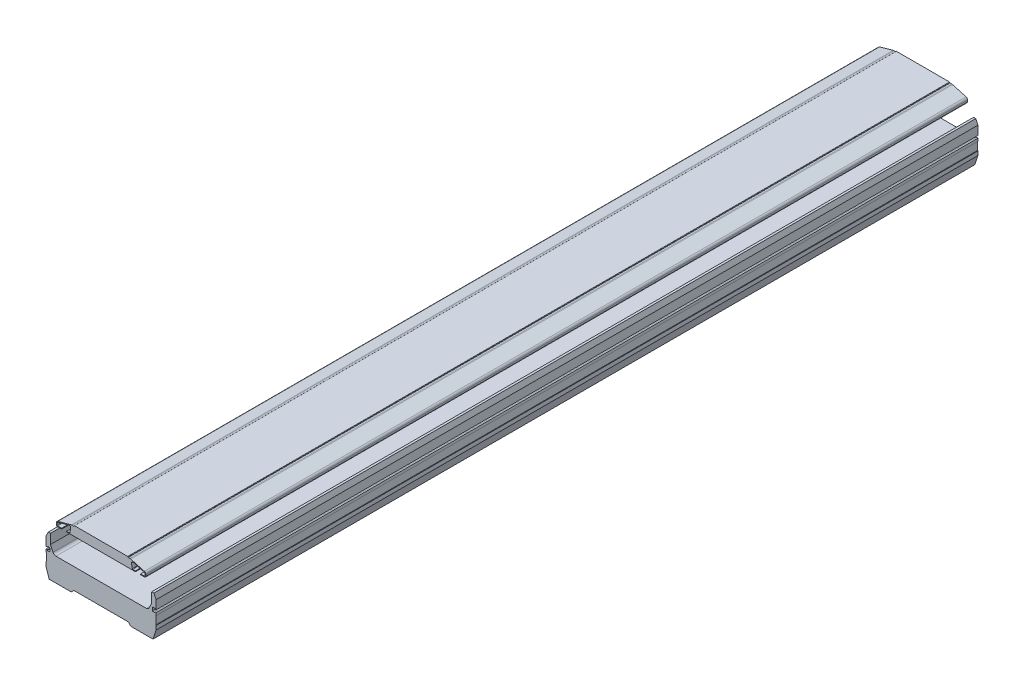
SolidWorks part; units mm, degrees
ref_plane "前视基准面" through (0, 0, 0) normal (0, 0, 1) x (1, 0, 0)
ref_plane "上视基准面" through (0, 0, 0) normal (0, 1, 0) x (1, 0, 0)
ref_plane "右视基准面" through (0, 0, 0) normal (1, 0, 0) x (0, 0, -1)
sketch "草图1" plane through (0, 0, 0) normal (0, 0, 1) x (1, 0, 0)
  line L0 (0, 0) -> (0, 72.5) construction
  line B0 (69.6454, 32) -> (-69.6454, 32)
  line B1 (-74.1769, 34.8869) -> (-78.1, 43.3)
  line B2 (-78.1, 43.3) -> (-78.1, 58.3)
  line B3 (-78.1, 58.3) -> (-81.5, 58.3)
  line B4 (-81.5, 58.3) -> (-85, 51.3)
  line B5 (-85, 51.3) -> (-85, 37.6)
  line B6 (-85, 37.6) -> (-83, 37.6)
  line B7 (-83, 37.6) -> (-83, 38.7)
  line B8 (-83, 38.7) -> (-80.2, 38.7)
  line B9 (-79.2, 37.7) -> (-79.2, 33.9)
  line B10 (-80.2, 32.9) -> (-83, 32.9)
  line B11 (-83, 32.9) -> (-83, 34)
  line B12 (-83, 34) -> (-85, 34)
  line B13 (-85, 34) -> (-85, 29.8)
  line B14 (-85, 29.8) -> (-84.5, 29.3)
  line B15 (-84.5, 29.3) -> (-84.5, 17.3)
  line B16 (-84.5, 17.3) -> (-85, 16.8)
  line B17 (-85, 16.8) -> (-85, 10.7)
  line B18 (-85, 10.7) -> (-80.1, -4)
  line B19 (-80.1, -4) -> (-46, -4)
  line B20 (-46, -4) -> (-42, 0)
  line B21 (-42, 0) -> (42, 0)
  line B22 (42, 0) -> (46, -4)
  line B23 (46, -4) -> (80.1, -4)
  line B24 (80.1, -4) -> (85, 10.7)
  line B25 (85, 10.7) -> (85, 16.8)
  line B26 (85, 16.8) -> (84.5, 17.3)
  line B27 (84.5, 17.3) -> (84.5, 29.3)
  line B28 (84.5, 29.3) -> (85, 29.8)
  line B29 (85, 29.8) -> (85, 34)
  line B30 (85, 34) -> (83, 34)
  line B31 (83, 34) -> (83, 32.9)
  line B32 (83, 32.9) -> (80.2, 32.9)
  line B33 (79.2, 33.9) -> (79.2, 37.7)
  line B34 (80.2, 38.7) -> (83, 38.7)
  line B35 (83, 38.7) -> (83, 37.6)
  line B36 (83, 37.6) -> (85, 37.6)
  line B37 (85, 37.6) -> (85, 51.3)
  line B38 (85, 51.3) -> (81.5, 58.3)
  line B39 (81.5, 58.3) -> (78.1, 58.3)
  line B40 (78.1, 58.3) -> (78.1, 43.3)
  line B41 (78.1, 43.3) -> (74.1769, 34.8869)
  arc B42 (-74.1769, 34.8869) -> (-69.6454, 32) centre (-69.6454, 37) ccw
  arc B43 (-79.2, 37.7) -> (-80.2, 38.7) centre (-80.2, 37.7) ccw
  arc B44 (-80.2, 32.9) -> (-79.2, 33.9) centre (-80.2, 33.9) ccw
  arc B45 (79.2, 33.9) -> (80.2, 32.9) centre (80.2, 33.9) ccw
  arc B46 (80.2, 38.7) -> (79.2, 37.7) centre (80.2, 37.7) ccw
  arc B47 (69.6454, 32) -> (74.1769, 34.8869) centre (69.6454, 37) ccw
  line B48 (41, 87) -> (-41, 87)
  line B49 (-42, 86) -> (-44.4254, 86)
  line B50 (-45.7616, 85.8182) -> (-66.6552, 80.0239)
  line B51 (-69, 76.9402) -> (-69, 74.5)
  line B52 (-67, 72.5) -> (-61, 72.5)
  line B53 (-61, 72.5) -> (-61, 73.7)
  line B54 (-61, 73.7) -> (-67, 73.7)
  line B55 (-67.8, 74.5) -> (-67.8, 76.9402)
  line B56 (-66.3345, 78.8675) -> (-49.6106, 83.5054)
  line B57 (-46.8846, 81.0074) -> (-48.1177, 74.3542)
  line B58 (-48.9043, 73.7) -> (-53, 73.7)
  line B59 (-53, 73.7) -> (-53, 72.5)
  line B60 (-53, 72.5) -> (53, 72.5)
  line B61 (53, 72.5) -> (53, 73.7)
  line B62 (53, 73.7) -> (48.9043, 73.7)
  line B63 (48.1177, 74.3542) -> (46.8846, 81.0074)
  line B64 (49.6106, 83.5054) -> (66.3345, 78.8675)
  line B65 (67.8, 76.9402) -> (67.8, 74.5)
  line B66 (67, 73.7) -> (61, 73.7)
  line B67 (61, 73.7) -> (61, 72.5)
  line B68 (61, 72.5) -> (67, 72.5)
  line B69 (69, 74.5) -> (69, 76.9402)
  line B70 (66.6552, 80.0239) -> (45.7616, 85.8182)
  line B71 (44.4254, 86) -> (42, 86)
  arc B72 (41.5, 86.5) -> (42, 86) centre (42, 86.5) ccw
  arc B73 (41.5, 86.5) -> (41, 87) centre (41, 86.5) ccw
  arc B74 (-41, 87) -> (-41.5, 86.5) centre (-41, 86.5) ccw
  arc B75 (-42, 86) -> (-41.5, 86.5) centre (-42, 86.5) ccw
  arc B76 (-44.4254, 86) -> (-45.7616, 85.8182) centre (-44.4254, 81) ccw
  arc B77 (-66.6552, 80.0239) -> (-69, 76.9402) centre (-65.8, 76.9402) ccw
  arc B78 (-69, 74.5) -> (-67, 72.5) centre (-67, 74.5) ccw
  arc B79 (-67.8, 74.5) -> (-67, 73.7) centre (-67, 74.5) ccw
  arc B80 (-66.3345, 78.8675) -> (-67.8, 76.9402) centre (-65.8, 76.9402) ccw
  arc B81 (-46.8846, 81.0074) -> (-49.6106, 83.5054) centre (-49.0281, 81.4047) ccw
  arc B82 (-48.9043, 73.7) -> (-48.1177, 74.3542) centre (-48.9043, 74.5) ccw
  arc B83 (48.1177, 74.3542) -> (48.9043, 73.7) centre (48.9043, 74.5) ccw
  arc B84 (49.6106, 83.5054) -> (46.8846, 81.0074) centre (49.0281, 81.4047) ccw
  arc B85 (67.8, 76.9402) -> (66.3345, 78.8675) centre (65.8, 76.9402) ccw
  arc B86 (67, 73.7) -> (67.8, 74.5) centre (67, 74.5) ccw
  arc B87 (67, 72.5) -> (69, 74.5) centre (67, 74.5) ccw
  arc B88 (69, 76.9402) -> (66.6552, 80.0239) centre (65.8, 76.9402) ccw
  arc B89 (45.7616, 85.8182) -> (44.4254, 86) centre (44.4254, 81) ccw
  dimension "D1" = 91
sketch_block_instance "块1-1"
sketch_block "块1"
sketch_block_instance "块2-1"
sketch_block "块2"
extrude "凸台-拉伸1" add sketch "草图1" along normal blind 1268
hole_wizard "打孔尺寸(%根据)内六角圆柱头螺钉的类型1" positions "草图2" profile "草图3" counterbore size "M8" standard "GB"
sketch "草图2" plane through (0, 58.3, 0) normal (0, 1, 0) x (1, 0, 0)
  line L0 (0, -1268) -> (0, -435.1793) construction
  line L1 (41, -1268) -> (-41, -1268) construction
  line L4 (46, -1268) -> (80.1, -1268) construction
  point P0 (70, -1194.5)
  point P9 (-70, -1194.5)
  point P16 (-70, -1044.5)
  point P18 (-70, -844.5)
  point P20 (-70, -644.5)
  point P22 (-70, -444.5)
  point P24 (-70, -244.5)
  point P26 (-70, 155.5)
  point P28 (-70, -44.5)
  point P32 (70, -44.5)
  point P33 (70, 155.5)
  point P34 (70, -244.5)
  point P35 (70, -444.5)
  point P36 (70, -644.5)
  point P37 (70, -844.5)
  point P38 (70, -1044.5)
  dimension "D1" = 140
  dimension "D2" = 73.5
  dimension "D3" = 150
  dimension "D4" = 200
  dimension "D5" = 200
  dimension "D6" = 200
  dimension "D7" = 200
  dimension "D8" = 200
  dimension "D9" = 200
sketch "草图3" plane through (70, 58.3, 1194.5) normal (1, 0, 0) x (0, 0, 1)
  line L0 (0, 0) -> (0, 62.3)
  line L1 (0, 62.3) -> (4.5, 62.3)
  line L3 (4.5, 62.3) -> (4.5, 48.3)
  line L4 (4.5, 48.3) -> (7.5, 48.3)
  line L5 (7.5, 48.3) -> (7.5, 0)
  line L7 (7.5, 0) -> (0, 0)
  line L11 (0, -6.35) -> (0, 107.95) construction
  dimension "通孔孔直径" = 9
  dimension "通孔孔深度" = 62.3
  dimension "柱形沉头孔直径" = 15
  dimension "柱形沉头孔深度" = 48.3
hole_wizard "M8 螺纹孔1" positions "草图4" profile "草图5" tap size "M8" standard "GB"
sketch "草图4" plane through (0, -4, 0) normal (0, -1, 0) x (-1, 0, 0)
  line L0 (0, -1268) -> (0, -1380.0153) construction
  line L1 (42, -1268) -> (-42, -1268) construction
  line L2 (80.1, -1268) -> (46, -1268) construction
  point P0 (70, -1209.5)
  point P2 (-70, -1209.5)
  point P12 (-70, -1059.5)
  point P14 (-70, -859.5)
  point P16 (-70, -659.5)
  point P18 (-70, -459.5)
  point P20 (-70, -259.5)
  point P22 (-70, -59.5)
  point P24 (-70, 140.5)
  point P27 (70, 140.5)
  point P28 (70, -59.5)
  point P29 (70, -259.5)
  point P30 (70, -459.5)
  point P31 (70, -659.5)
  point P32 (70, -859.5)
  point P33 (70, -1059.5)
  dimension "D1" = 140
  dimension "D2" = 58.5
  dimension "D3" = 150
  dimension "D4" = 200
  dimension "D5" = 200
  dimension "D6" = 200
  dimension "D7" = 200
  dimension "D8" = 200
  dimension "D9" = 200
sketch "草图5" plane through (-70, -4, 1209.5) normal (1, 0, 0) x (0, 0, -1)
  line L0 (0, 0) -> (0, 17.7929)
  line L1 (0, 17.7929) -> (3.4, 15.75)
  line L2 (3.4, 15.75) -> (3.4, 0)
  line L5 (3.4, 0) -> (0, 0)
  line L10 (0, 17.7929) -> (-3.4, 15.75) construction
  line L11 (0, -6.35) -> (0, 107.95) construction
  dimension "螺纹孔钻头直径" = 6.8
  dimension "螺纹孔钻头深度" = 15.75
  dimension "导头角度" = 118
